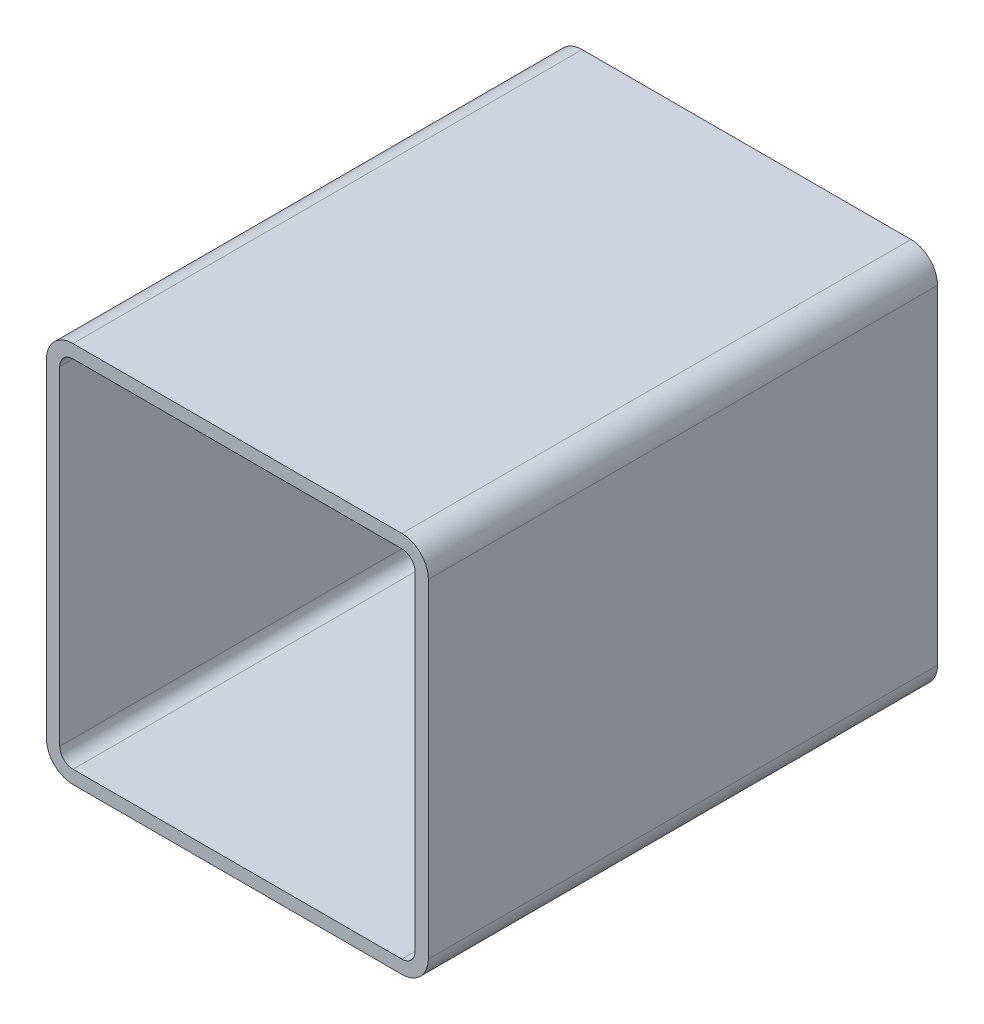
SolidWorks part; units mm, degrees
ref_plane "Front Plane" through (0, 0, 0) normal (0, 0, 1) x (1, 0, 0)
ref_plane "Top Plane" through (0, 0, 0) normal (0, 1, 0) x (1, 0, 0)
ref_plane "Right Plane" through (0, 0, 0) normal (1, 0, 0) x (0, 0, -1)
sketch "Sketch1" plane through (0, 0, 0) normal (0, 0, 1) x (1, 0, 0)
sketch_block_instance "HSS9x9x0.3125-1"
sketch_block "HSS9x9x0.3125"
extrude "Boss-Extrude1" add sketch "Sketch1" along normal blind 304.8
